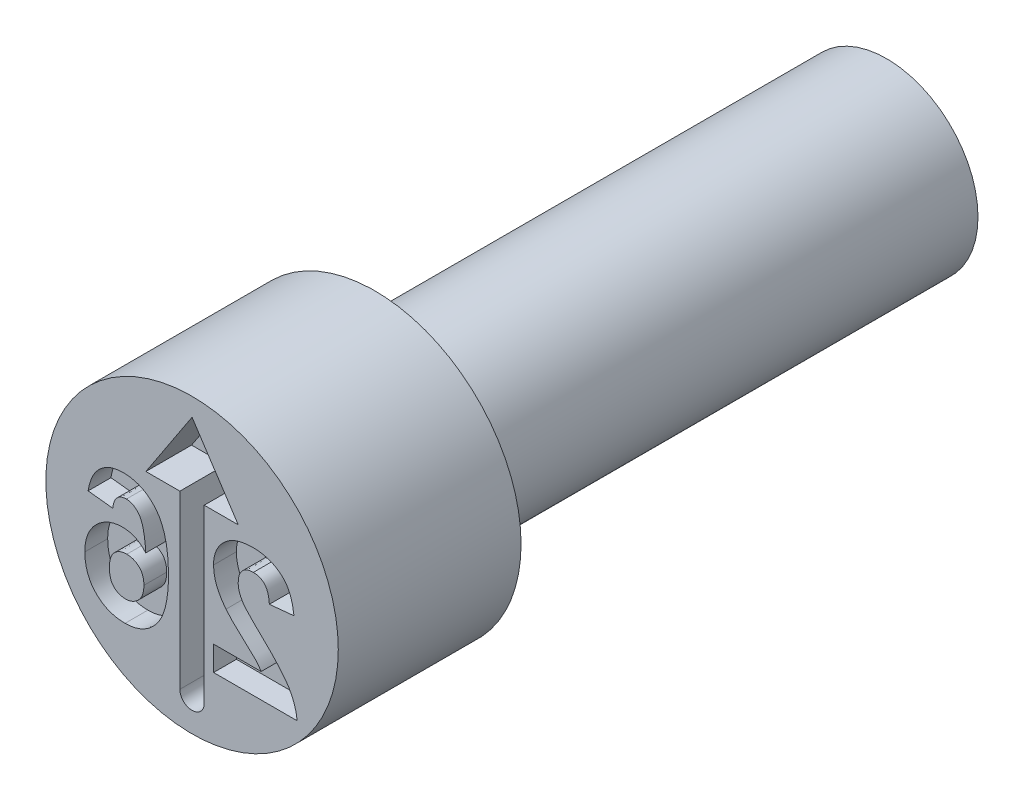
SolidWorks part; units mm, degrees
ref_plane "Front Plane" through (0, 0, 0) normal (0, 0, 1) x (1, 0, 0)
ref_plane "Top Plane" through (0, 0, 0) normal (0, 1, 0) x (1, 0, 0)
ref_plane "Right Plane" through (0, 0, 0) normal (1, 0, 0) x (0, 0, -1)
sketch "Sketch2" plane through (0, 0, 0) normal (1, 0, 0) x (0, 0, -1)
  line L0 (0.4039, 0) -> (50000.4039, 0) construction
  line L6 (0, 0.8) -> (0, 0)
  line L7 (1, 0.8) -> (0, 0.8)
  line L8 (1, 0.5) -> (1, 0.8)
  line L9 (3.8, 0.5) -> (1, 0.5)
  line L10 (3.8, 0) -> (3.8, 0.5)
  line L11 (0, 0) -> (3.8, 0)
  dimension "D1" = 1.6
  dimension "D2" = 1
  dimension "D3" = 3.8
  dimension "D4" = 1
revolve "Revolve1" add sketch "Sketch2" angle 360 about L0
sketch "Sketch3" plane through (0, 0, 0) normal (0, 0, 1) x (1, 0, 0)
  line L0 (0, 0) -> (0, 35000) construction
  line L1 (0.0667, 0.3172) -> (0.0667, -0.6217)
  line L2 (0.2527, 0.3172) -> (0.0667, 0.3172)
  line L3 (0, 0.7007) -> (0.2527, 0.3172)
  line L15 (0, 0.7007) -> (-0.2527, 0.3172)
  line L16 (-0.2527, 0.3172) -> (-0.0667, 0.3172)
  line L17 (-0.0667, 0.3172) -> (-0.0667, -0.6217)
  arc A2 (-0.0667, -0.6217) -> (0.0667, -0.6217) centre (0, -0.6217) ccw
extrude "Cut-Extrude4" cut sketch "Sketch3" against normal blind 0.25
sketch "Sketch4" plane through (0, 0, 0) normal (0, 0, 1) x (1, 0, 0)
  text T0 "2 6" font "Arial" height 0.7
  dimension "D2" = 0.45
extrude "Cut-Extrude5" cut sketch "Sketch4" against normal blind 0.125
